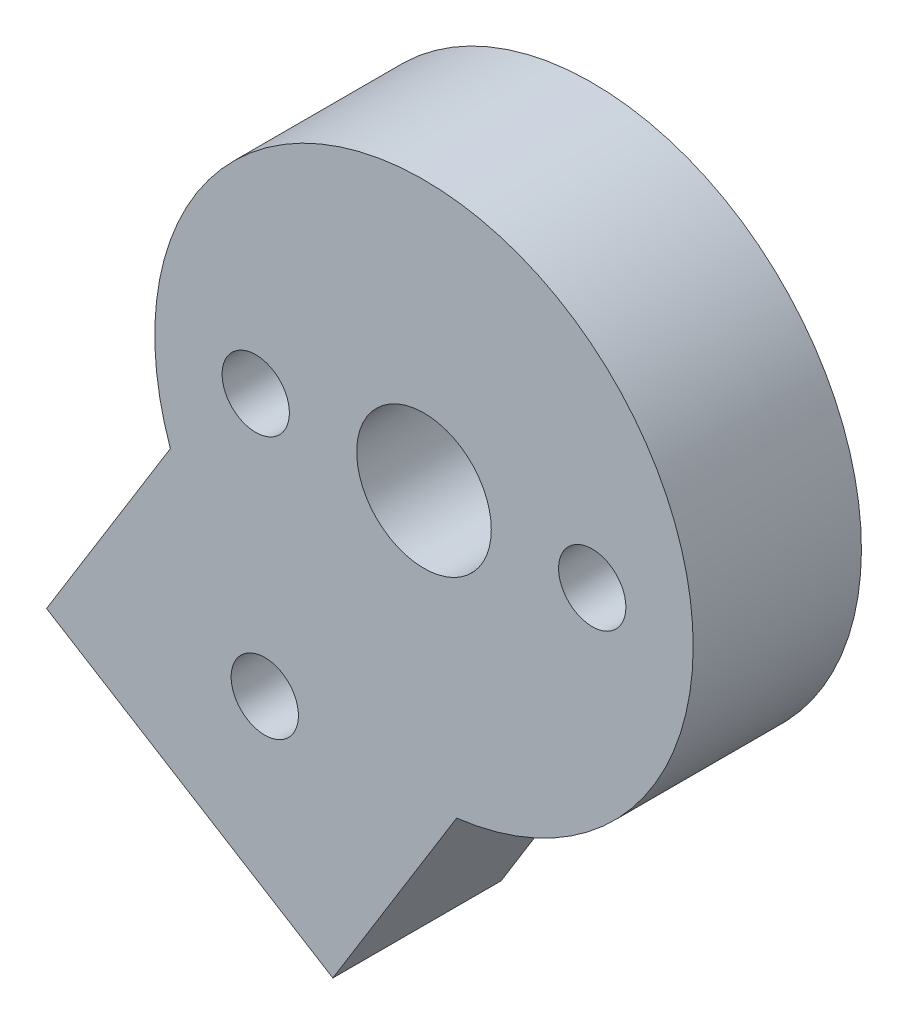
SolidWorks part; units mm, degrees
ref_plane "Front Plane" through (0, 0, 0) normal (0, 0, 1) x (1, 0, 0)
ref_plane "Top Plane" through (0, 0, 0) normal (0, 1, 0) x (1, 0, 0)
ref_plane "Right Plane" through (0, 0, 0) normal (1, 0, 0) x (0, 0, -1)
sketch "Sketch1" plane through (0, 0, 0) normal (0, 0, 1) x (1, 0, 0)
  line L0 (0, 0) -> (5.661, 0) construction
  line L1 (0, 0) -> (-3.0693, -4.9674) construction
  line L3 (-7.5361, -2.6845) -> (-11.2156, -8.6395)
  line L4 (-11.2156, -8.6395) -> (-2.7085, -13.8958)
  line L5 (-2.7085, -13.8958) -> (0.971, -7.9409)
  arc A0 (0.971, -7.9409) -> (-7.5361, -2.6845) centre (0, 0) ccw
  dimension "D1" = 238.289
  dimension "D2" = 7
extrude "Boss-Extrude1" add sketch "Sketch1" along normal blind 5
sketch "Sketch2" plane through (0, 0, 5) normal (0, 0, 1) x (1, 0, 0)
  line L0 (0, 0) -> (-6.962, -11.2677) construction
  line L1 (-11.2156, -8.6395) -> (-2.7085, -13.8958) construction
  line L2 (0, 0) -> (5.6636, 0) construction
  line L3 (0, 0) -> (-5.2206, 0) construction
  circle A0 centre (0, 0) radius 2
  circle A1 centre (-4.7307, -7.6564) radius 1
  circle A2 centre (5, 0) radius 1
  circle A3 centre (-5, 0) radius 1
  dimension "D1" = 9
  dimension "D2" = 5
  dimension "D3" = 5
extrude "Cut-Extrude1" cut sketch "Sketch2" against normal blind 5
sketch "Sketch3" plane through (0, 0, 5) normal (0, 0, 1) x (1, 0, 0)
  line L0 (0, 0) -> (7.5806, 0)
